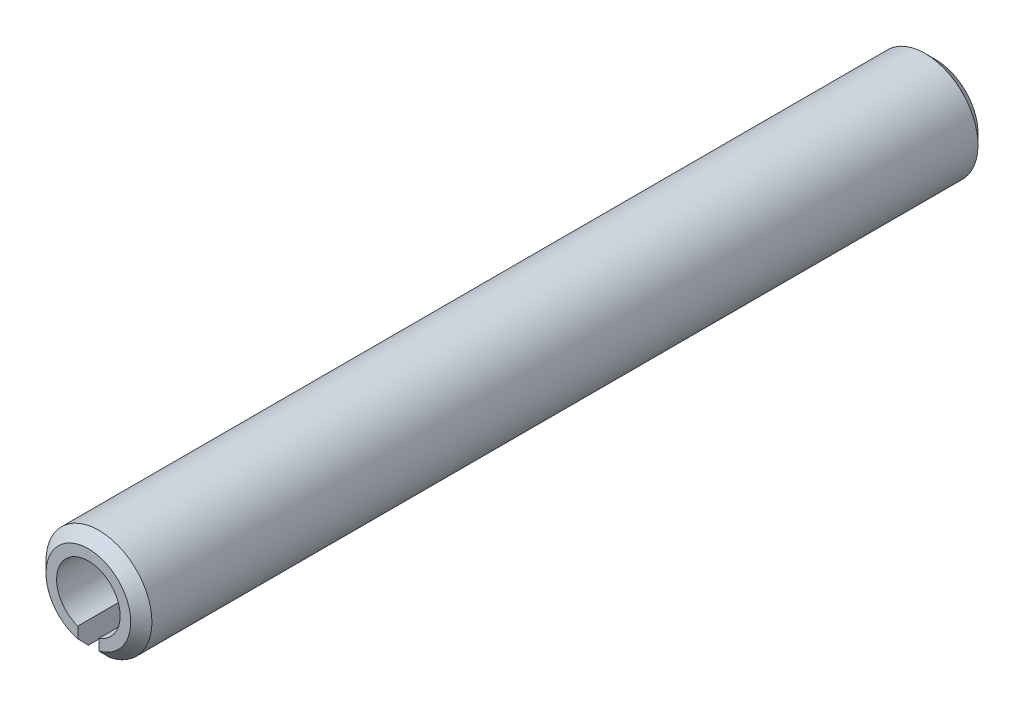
SolidWorks part; units mm, degrees
ref_plane "Plan de face" through (0, 0, 0) normal (0, 0, 1) x (1, 0, 0)
ref_plane "Plan de dessus" through (0, 0, 0) normal (0, 1, 0) x (1, 0, 0)
ref_plane "Plan de droite" through (0, 0, 0) normal (1, 0, 0) x (0, 0, -1)
sketch "Esquisse1" plane through (0, 0, 0) normal (0, 0, 1) x (1, 0, 0)
  line L2 (-0.5, -1.4142) -> (-0.5, -2.4495)
  line L4 (0.5, -1.4142) -> (0.5, -2.4495)
  arc A0 (0.5, -2.4495) -> (-0.5, -2.4495) centre (0, 0) ccw
  arc A1 (0.5, -1.4142) -> (-0.5, -1.4142) centre (0, 0) ccw
  dimension "D1" = 1.5
  dimension "D2" = 2.5
  dimension "D3" = 0.5
  dimension "D4" = 0.5
extrude "Extrusion1" add sketch "Esquisse1" along normal blind 40
chamfer "Chanfrein1" distance 0.5 angle 45 2 edges at (0, 2.5, 0) (0, 2.5, 40)
